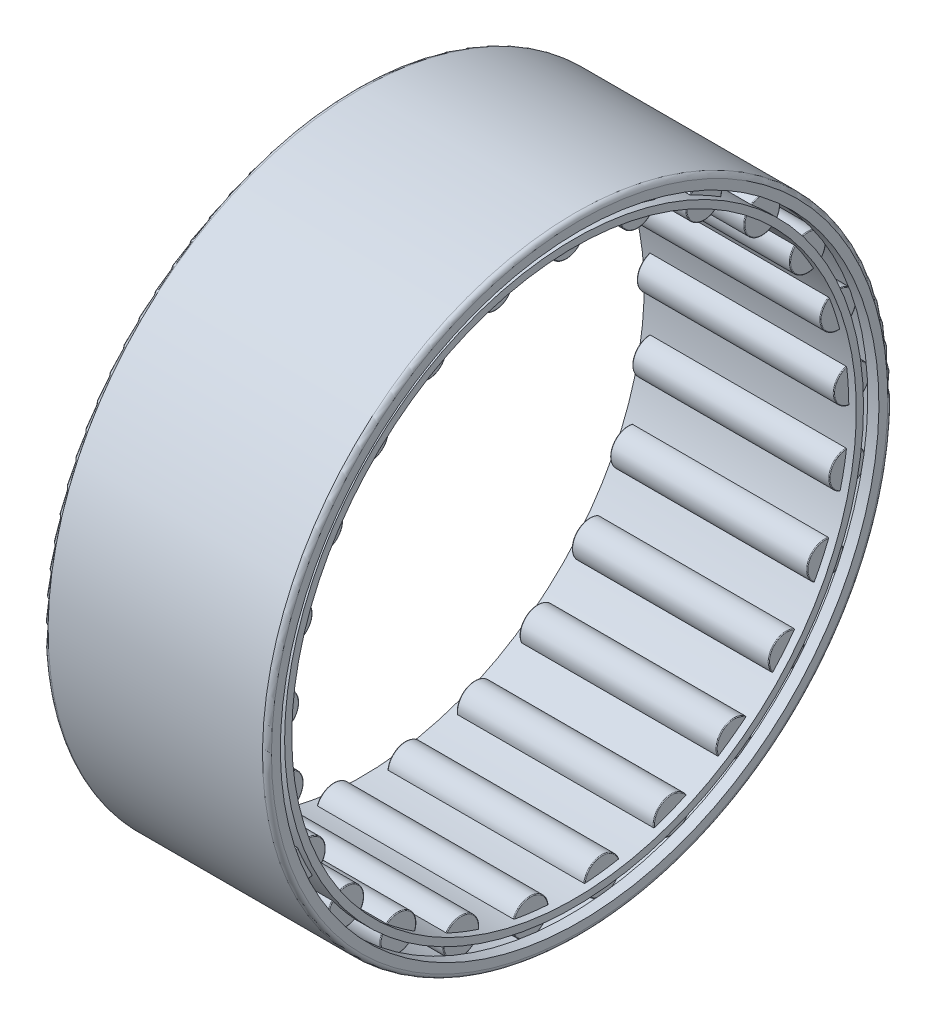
SolidWorks part; units mm, degrees
ref_plane "Plane1" through (0, 0, 0) normal (0, 0, 1) x (1, 0, 0)
ref_plane "Plane2" through (0, 0, 0) normal (0, 1, 0) x (1, 0, 0)
ref_plane "Plane3" through (0, 0, 0) normal (1, 0, 0) x (0, 0, -1)
sketch "Clipboard" plane through (0, 0, 0) normal (0, 0, 1) x (1, 0, 0)
  line L0 (-10, 0) -> (10, 0) construction
  line L1 (0, 0) -> (20.2657, -9.45)
  line L2 (0, 0) -> (36.8323, 17.1752)
  line L3 (0, 0) -> (20.2657, -9.45)
  line L4 (0, 0) -> (-76.2, -2.661)
sketch "InnRacSke" plane through (0, 0, 0) normal (0, 0, 1) x (1, 0, 0)
  line L0 (-14.2875, 42.545) -> (-15.875, 42.545)
  line L1 (-15.875, 42.545) -> (-15.875, 43.815)
  line L2 (-15.24, 44.45) -> (15.24, 44.45)
  line L4 (15.875, 43.815) -> (15.875, 42.545)
  line L5 (15.875, 42.545) -> (14.2875, 42.545)
  line L6 (14.2875, 42.545) -> (14.2875, 43.18)
  line L7 (14.2875, 43.18) -> (-14.2875, 43.18)
  line L8 (-14.2875, 43.18) -> (-14.2875, 42.545)
  line L9 (-31.75, 0) -> (31.75, 0) construction
  arc A0 (-15.875, 43.815) -> (-15.24, 44.45) centre (-15.24, 43.815) cw
  arc A2 (15.24, 44.45) -> (15.875, 43.815) centre (15.24, 43.815) cw
revolve "Race" add sketch "InnRacSke" angle 360 about L9
sketch "RolDetSke" plane through (0, 0, 0) normal (0, 0, 1) x (1, 0, 0)
  line L0 (-14.0018, 43.0789) -> (-14.0017, 40.64)
  line L1 (-14.0017, 40.64) -> (14.0017, 40.64)
  line L2 (14.0017, 40.64) -> (14.0018, 43.0789)
  line L3 (13.9001, 43.1805) -> (-13.9001, 43.1805)
  line L4 (-28.575, 40.64) -> (28.575, 40.64) construction
  arc A0 (14.0018, 43.0789) -> (13.9001, 43.1805) centre (13.9001, 43.0789) ccw
  arc A1 (-13.9001, 43.1805) -> (-14.0018, 43.0789) centre (-13.9001, 43.0789) ccw
revolve "RollerDetailed" add sketch "RolDetSke" angle 360 about L4
ref_axis "Axis1" through (-50, 0, 0) along (1, 0, 0)
sketch "CagSpiSke" plane through (0, 0, 0) normal (0, 0, 1) x (1, 0, 0)
  line L0 (15.0812, 40.1319) -> (15.0812, 41.1481)
  line L1 (15.0812, 41.1481) -> (-15.0813, 41.1481)
  line L2 (-15.0813, 41.1481) -> (-15.0813, 40.1319)
  line L3 (-15.0813, 40.1319) -> (15.0812, 40.1319)
  line L4 (-31.75, 0) -> (31.75, 0) construction
revolve "CageSpine" add sketch "CagSpiSke" angle 360 about L4
pattern_circular "RollersDetailed" count 25 every 14.4 about axis through (-50, 0, 0) along (1, 0, 0) of "RollerDetailed"
sketch "RolSimSke" plane through (0, 0, 0) normal (0, 0, 1) x (1, 0, 0)
  line L0 (-25.4, 0) -> (25.4, 0) construction
  line L2 (-13.9001, 43.181) -> (13.9001, 43.181)
  line L3 (-14.0018, 43.0794) -> (-14.0018, 38.2016)
  line L4 (-13.9001, 38.1) -> (13.9001, 38.1)
  line L5 (14.0017, 43.0794) -> (14.0017, 38.2016)
  arc A0 (-14.0018, 38.2016) -> (-13.9001, 38.1) centre (-13.9001, 38.2016) ccw
  arc A1 (-13.9001, 43.181) -> (-14.0018, 43.0794) centre (-13.9001, 43.0794) ccw
  arc A2 (14.0017, 43.0794) -> (13.9001, 43.181) centre (13.9001, 43.0794) ccw
  arc A3 (13.9001, 38.1) -> (14.0017, 38.2016) centre (13.9001, 38.2016) ccw
  point P10 (-14.0018, 38.1)
  point P15 (14.0017, 43.181)
  point P18 (14.0017, 38.1)
revolve "RollersSimplified" [suppressed] add sketch "RolSimSke" angle 360 about L0
equation "\"BallCLRad@Clipboard\" =  ( \"D1@InnRacSke\" + \"Bore@Clipboard\" )  / 4"
equation "\"RollerCLRad@RolDetSke\" = \"BallCLRad@Clipboard\""
equation "\"halfCyl@InnRacSke\" = \"Cyl_Len@InnRacSke\" / 2"
equation "\"Roller_length@RolDetSke\" = \"Cyl_Len@InnRacSke\" * .98"
equation "\"halfLength@RolDetSke\" = \"Roller_length@RolDetSke\" / 2"
equation "\"Roller_diameter@RolDetSke\" =  ( \"D1@InnRacSke\" - \"Bore@Clipboard\" )  / 2 + .001"
equation "\"Roller_radius@RolDetSke\" = \"Roller_diameter@RolDetSke\" / 50"
equation "\"Cage_width@CagSpiSke\" =  ( \"Cyl_Len@InnRacSke\" + \"Width@InnRacSke\" )  / 2"
equation "\"halfWidth@CagSpiSke\" = \"Cage_width@CagSpiSke\" / 2"
equation "\"Cage_thickness@CagSpiSke\"  = \"Roller_diameter@RolDetSke\" / 5"
equation "\"D2@CagSpiSke\" =  \"RollerCLRad@RolDetSke\" * 2 - \"Cage_thickness@CagSpiSke\""
equation "\"Roller_length@RolSimSke\" = \"Cyl_Len@InnRacSke\" * .98"
equation "\"halfWidth@RolSimSke\" = \"Roller_length@RolSimSke\" / 2"
equation "\"D1@RolSimSke\" = \"Roller_radius@RolDetSke\""
equation "\"Roller_diameter@RolSimSke\" =  ( \"D1@InnRacSke\" - \"Bore@Clipboard\" )  / 2 + .001"
equation "\"Bore@RolSimSke\" = \"Bore@Clipboard\""
equation "\"Max_count@Clipboard\" = int( 3.14159265 / atn(( \"Roller_diameter@RolDetSke\" / 2) / sqr( \"RollerCLRad@RolDetSke\"  *  \"RollerCLRad@RolDetSke\" - ( \"Roller_diameter@RolDetSke\" / 2) *  ( \"Roller_diameter@R"
equation "\"Max_count@Clipboard\" = ((sgn( \"Max_count@Clipboard\" - \"Count@Clipboard\" )-1)*( \"Max_count@Clipboard\" - \"Count@Clipboard\" ))/-2+ \"Count@Clipboard\""
equation "\"Count@RollersDetailed\" = int( \"Show_count@Clipboard\" ) "
equation "\"Count@RollersDetailed\" = ((sgn( \"Count@RollersDetailed\" - \"Max_count@Clipboard\" )-1)*( \"Count@RollersDetailed\" - \"Max_count@Clipboard\" ))/-2+ \"Max_count@Clipboard\""
equation "\"Count@RollersDetailed\" = ((sgn( \"Count@RollersDetailed\" - \"Min_count@Clipboard\" )+1)*( \"Count@RollersDetailed\" - \"Min_count@Clipboard\"))/2 +\"Min_count@Clipboard\""
equation "\"Angle@RollersDetailed\" = 360.0 / \"Max_count@Clipboard\""
equation "\"Angle@CageSpine\" =  \"Angle@RollersDetailed\" * ( \"Count@RollersDetailed\" -1 + int( \"Count@RollersDetailed\" / \"Max_count@Clipboard\" ) )  + 0.001 -  int( \"Count@RollersDetailed\" / \"Max_count@Clipboard\" "
equation "\"Angle@CageSpine\" =  \"Angle@CageSpine\" * int( \"Min_count@Clipboard\" / 2) + int(1 / \"Min_count@Clipboard\")  * 0.001"
